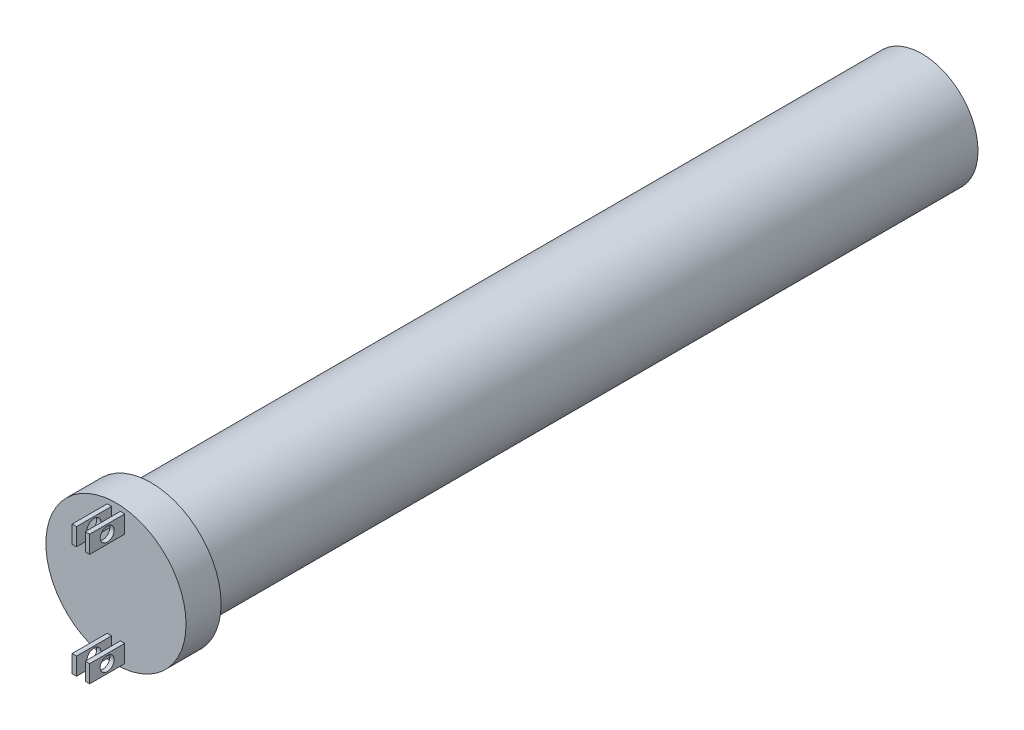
SolidWorks part; units mm, degrees
ref_plane "Front Plane" through (0, 0, 0) normal (0, 0, 1) x (1, 0, 0)
ref_plane "Top Plane" through (0, 0, 0) normal (0, 1, 0) x (1, 0, 0)
ref_plane "Right Plane" through (0, 0, 0) normal (1, 0, 0) x (0, 0, -1)
sketch "Sketch1" plane through (0, 0, 0) normal (0, 0, 1) x (1, 0, 0)
  circle A0 centre (0, 0) radius 20.32
  dimension "D1" = 40.64
extrude "Boss-Extrude1" add sketch "Sketch1" along normal blind 279.4
sketch "Sketch2" plane through (0, 0, 279.4) normal (0, 0, 1) x (1, 0, 0)
  circle A1 centre (0, 0) radius 25.4
extrude "Boss-Extrude2" add sketch "Sketch2" along normal blind 12.7
sketch "Sketch3" plane through (0, 0, 292.1) normal (0, 0, 1) x (1, 0, 0)
  line L0 (0, 0) -> (0, 20.32)
  line L1 (0, -55) -> (0, 55) construction
  line L2 (55, 0) -> (-55, 0) construction
  line L3 (-3.175, 17.145) -> (3.175, 17.145)
  line L4 (-3.175, 17.145) -> (-3.175, 23.495)
  line L5 (-3.175, 23.495) -> (3.175, 23.495)
  line L6 (3.175, 17.145) -> (3.175, 23.495)
  line L7 (-3.175, 17.145) -> (3.175, 23.495) construction
  line L8 (-3.175, 23.495) -> (3.175, 17.145) construction
  line L9 (-3.175, -17.145) -> (-3.175, -23.495)
  line L10 (-3.175, -17.145) -> (3.175, -17.145)
  line L11 (3.175, -17.145) -> (3.175, -23.495)
  line L12 (-3.175, -23.495) -> (3.175, -23.495)
  dimension "D1" = 20.32
  dimension "D2" = 6.35
  dimension "D3" = 6.35
extrude "Boss-Extrude3" add sketch "Sketch3" along normal blind 12.7
sketch "Sketch4" plane through (-3.175, 0, 0) normal (-1, 0, 0) x (0, 0, 1)
  line L0 (304.8, 17.145) -> (292.1, 23.495)
  line L1 (304.8, 23.495) -> (292.1, 17.145)
  line L2 (55, 0) -> (-55, 0) construction
  circle A0 centre (298.45, 20.32) radius 2.54
  circle A1 centre (298.45, -20.32) radius 2.54
  dimension "D1" = 5.08
extrude "Cut-Extrude1" cut sketch "Sketch4" against normal blind 6.35 contours A1 | A0
sketch "Sketch5" plane through (3.175, 0, 0) normal (1, 0, 0) x (0, 0, -1)
  line L0 (-304.8, -23.495) -> (-304.8, -17.145)
  line L1 (-304.8, -17.145) -> (-292.1, -17.145)
  line L2 (-292.1, -17.145) -> (-292.1, -23.495)
  line L3 (-292.1, 25.4) -> (-292.1, -25.4) construction
  line L4 (-292.1, -17.145) -> (-292.1, -23.495) construction
  line L5 (-292.1, -23.495) -> (-304.8, -23.495)
extrude "Cut-Extrude2" cut sketch "Sketch5" against normal blind 3.175 from offset 1.5875
mirror "Mirror1" about plane through (0, 0, 0) normal (0, 1, 0) of "Cut-Extrude2"
